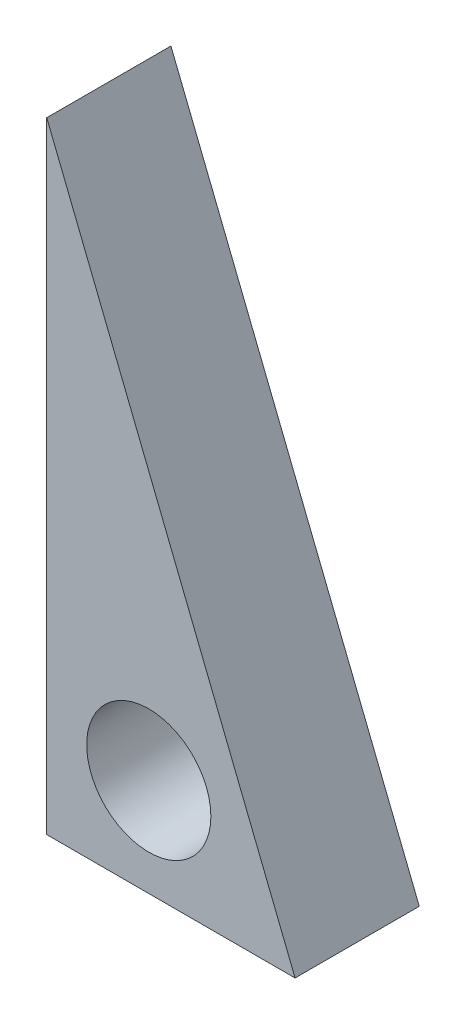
SolidWorks part; units mm, degrees
ref_plane "Front Plane" through (0, 0, 0) normal (0, 0, 1) x (1, 0, 0)
ref_plane "Top Plane" through (0, 0, 0) normal (0, 1, 0) x (1, 0, 0)
ref_plane "Right Plane" through (0, 0, 0) normal (1, 0, 0) x (0, 0, -1)
sketch "Sketch1" plane through (0, 0, 0) normal (0, 0, 1) x (1, 0, 0)
  line L0 (0, 5) -> (2, 0)
  line L1 (0, 0) -> (2, 0)
  line L2 (0, 0) -> (0, 5)
  line L3 (0, 5) -> (2, 5) construction
  line L4 (2, 0) -> (2, 5) construction
  dimension "D1" = 2
  dimension "D2" = 5
extrude "Extrude1" add sketch "Sketch1" along normal blind 1
sketch "Sketch2" plane through (0, 0, 1) normal (0, 0, 1) x (1, 0, 0)
  circle A0 centre (0.8219, 0.7882) radius 0.5
  dimension "D1" = 1
extrude "Extrude2" cut sketch "Sketch2" against normal blind 10
